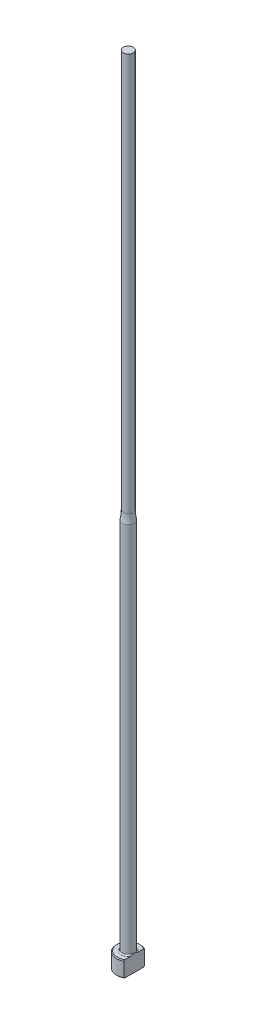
SolidWorks part; units mm, degrees
ref_plane "Front Plane" through (0, 0, 0) normal (0, 0, 1) x (1, 0, 0)
ref_plane "Top Plane" through (0, 0, 0) normal (0, 1, 0) x (1, 0, 0)
ref_plane "Right Plane" through (0, 0, 0) normal (1, 0, 0) x (0, 0, -1)
sketch "Sketch1" plane through (0, 0, 0) normal (0, 0, 1) x (1, 0, 0)
  line L0 (0, 259.9588) -> (0, -15.1925) construction
  line L1 (0, 0) -> (-3, 0)
  line L2 (-3, 0) -> (-3, 4)
  line L3 (-3, 4) -> (-1.5, 4)
  line L4 (-1.25, 100) -> (-1.25, 200)
  line L5 (-1.25, 200) -> (0, 200)
  line L6 (0, 200) -> (0, 0)
  line L7 (-1.5, 4) -> (-1.5, 97.778)
  arc A0 (-1.5, 97.778) -> (-1.25, 100) centre (-11.25, 100) ccw
  point P13 (-1.5, 0)
  dimension "D1" = 10
  dimension "L" = 200
  dimension "H" = 6
  dimension "T" = 4
  dimension "D" = 2.5
  dimension "B" = 3
  dimension "S" = 100
revolve "Revolve1" add sketch "Sketch1" angle 360 about L0
chamfer "Chamfer1" distance 0.2 angle 45 2 edges at (0, 4, 3) (0, 0, 3)
fillet "Fillet1" radius 0.3 1 edges at (0, 4, 1.5)
sketch "Sketch2" plane through (0, 0, 0) normal (0, 1, 0) x (1, 0, 0)
  line L0 (1.5, -2.5981) -> (1.5, 2.5981)
  circle A0 centre (0, 0) radius 3 construction
  arc A1 (1.5, -2.5981) -> (1.5, 2.5981) centre (0, 0) ccw
  circle A2 centre (0, 0) radius 1.5 construction
extrude "Keyed Head" cut sketch "Sketch2" along normal through all
